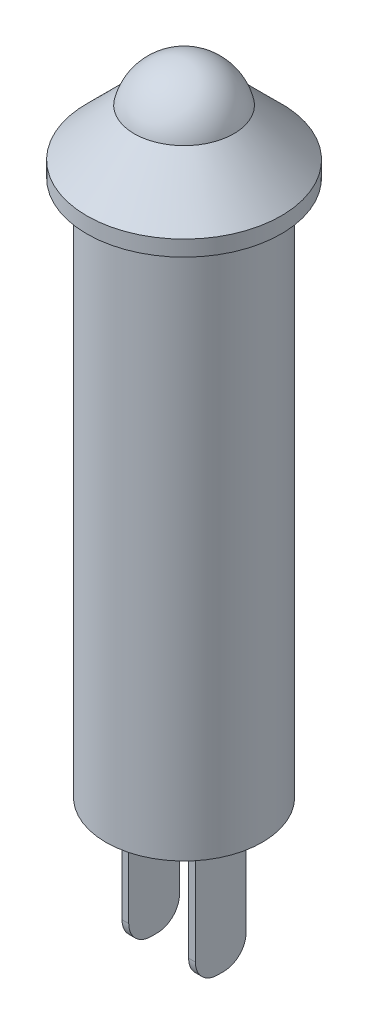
SolidWorks part; units mm, degrees
ref_plane "Front" through (0, 0, 0) normal (0, 0, 1) x (1, 0, 0)
ref_plane "Top" through (0, 0, 0) normal (0, 1, 0) x (1, 0, 0)
ref_plane "Right" through (0, 0, 0) normal (1, 0, 0) x (0, 0, -1)
sketch "Sketch1"
  dimension "D6" = 5.842
  dimension "D1" = 30.48
  dimension "D2" = 8.89
  dimension "D3" = 11.049
  dimension "D4" = 36.322
  dimension "D5" = 0.889
  dimension "D7" = 45
  dimension "D8" = 3.81
revolve "Revolve1" add sketch "Sketch1" angle 360 about L6
sketch "Sketch2"
  dimension "D1" = 0.381
  dimension "D2" = 0.381
  dimension "D3" = 2.8829
  dimension "D4" = 2.8829
  dimension "D5" = 1.4414
  dimension "D6" = 4.1656
  dimension "D7" = 2.0828
  dimension "D8" = 1.27
  dimension "D9" = 0.635
  dimension "D10" = 2.8829
extrude "Extrude1" add sketch "Sketch2" along normal blind 7.62
fillet "Fillet1" radius 1.27 4 edges at (-1.8923, -7.62, -1.4414) (-1.8923, -7.62, 1.4414) (1.8923, -7.62, -1.4414) (1.8923, -7.62, 1.4415)
